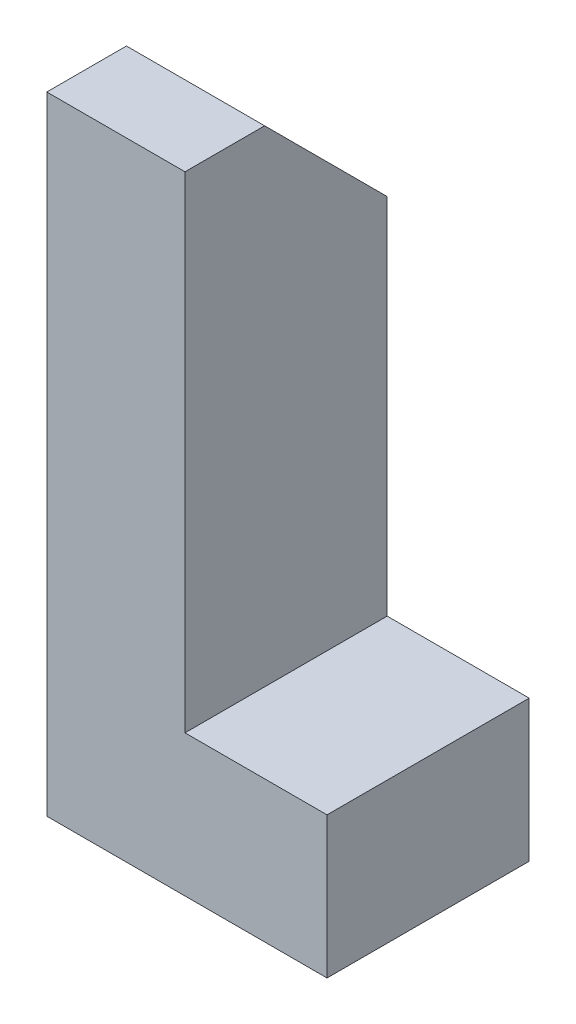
SolidWorks part; units mm, degrees
ref_plane "Front Plane" through (0, 0, 0) normal (0, 0, 1) x (1, 0, 0)
ref_plane "Top Plane" through (0, 0, 0) normal (0, 1, 0) x (1, 0, 0)
ref_plane "Right Plane" through (0, 0, 0) normal (1, 0, 0) x (0, 0, -1)
sketch "Sketch1" plane through (0, 0, 0) normal (0, 0, 1) x (1, 0, 0)
  line L0 (0, 0) -> (0, 17.5755)
  line L1 (0, 17.5755) -> (-17.6686, 17.5755)
  line L2 (-17.6686, 17.5755) -> (-17.6686, 78.0148)
  line L3 (-17.6686, 78.0148) -> (-34.858, 78.0148)
  line L4 (-34.858, 78.0148) -> (-34.858, 0)
  line L5 (-34.858, 0) -> (0, 0)
extrude "Extrude1" add sketch "Sketch1" along normal blind 25.146
chamfer "Chamfer1" distance 15.24 angle 45 1 edges at (-26.2633, 78.0148, 0)
